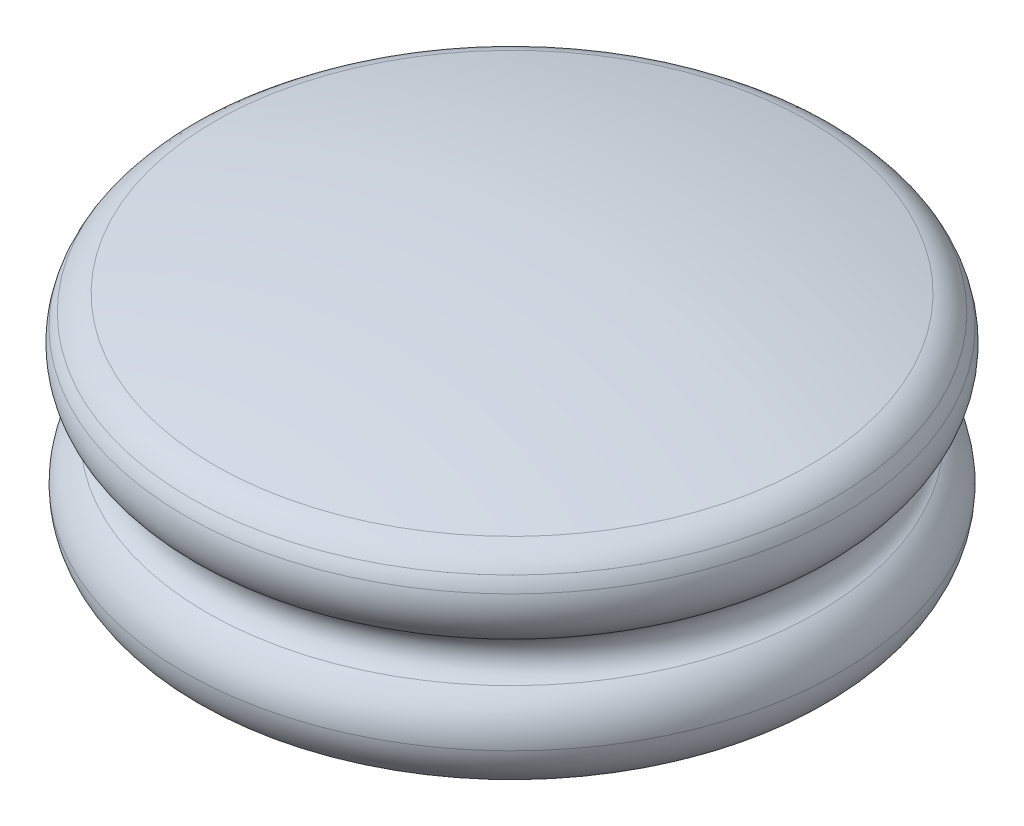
SolidWorks part; units mm, degrees
ref_plane "Alzado" through (0, 0, 0) normal (0, 0, 1) x (1, 0, 0)
ref_plane "Planta" through (0, 0, 0) normal (0, 1, 0) x (1, 0, 0)
ref_plane "Vista lateral" through (0, 0, 0) normal (1, 0, 0) x (0, 0, -1)
sketch "Croquis1" plane through (0, 0, 0) normal (0, 1, 0) x (1, 0, 0)
  circle A0 centre (0, 0) radius 30
extrude "Saliente-Extruir1" add sketch "Croquis1" along normal blind 90
sketch "Croquis2" plane through (0, 90, 0) normal (0, 1, 0) x (1, 0, 0)
  circle A0 centre (0, 0) radius 28
sketch "Croquis3" plane through (0, 90, 0) normal (0, 1, 0) x (1, 0, 0)
  line L0 (0, 0) -> (-30, 0) construction
  line L2 (-31, -1.5) -> (-29, -1.5)
  line L3 (-31, -1.5) -> (-31, 1.5)
  line L4 (-31, 1.5) -> (-29, 1.5)
  line L5 (-29, -1.5) -> (-29, 1.5)
  line L6 (-31, -1.5) -> (-29, 1.5) construction
  line L7 (-31, 1.5) -> (-29, -1.5) construction
  circle A0 centre (0, 0) radius 30 construction
  dimension "D1" = 3
  dimension "D2" = 2
extrude "Saliente-Extruir2" add sketch "Croquis3" against normal blind 3 separate body
ref_plane "Plano1" through (0, 85, 0) normal (0, 1, 0) x (1, 0, 0)
sketch "Croquis5" plane through (0, 85, 0) normal (0, 1, 0) x (1, 0, 0)
  line L0 (0, 0) -> (-29.2874, -6.5) construction
  line L5 (-31, -1.5) -> (-29, -1.5) construction
  line L6 (-30.1011, -7.4489) -> (-28.1486, -7.0155)
  line L7 (-28.1486, -7.0155) -> (-28.4736, -5.5511)
  line L8 (-28.4736, -5.5511) -> (-30.4261, -5.9845)
  line L9 (-30.4261, -5.9845) -> (-30.1011, -7.4489)
  circle A0 centre (0, 0) radius 30 construction
  dimension "D1" = 5
  dimension "D2" = 2
  dimension "D3" = 1
  dimension "D4" = 1.5
  dimension "D5" = 0.75
sketch "Croquis10" plane through (0, 0, 0) normal (1, 0, 0) x (0, 0, -1)
  line L0 (37.5, 90) -> (37.5, 100) construction
  line L1 (37.5, 100) -> (37.5, 105) construction
  line L2 (37.5, 105) -> (37.5, 115) construction
  line L3 (37.5, 115) -> (0, 115) construction
  line L4 (0, 115) -> (0, 90) construction
  line L5 (1.5, 90) -> (-1.5, 90) construction
  line L6 (0, 90) -> (37.5, 90) construction
  line L7 (37.5, 90) -> (40.2386, 90) construction
  line L8 (40.2386, 90) -> (40.2386, 115) construction
  line L9 (40.2386, 115) -> (37.5, 115) construction
  line L10 (0, 115) -> (0, 119.6645) construction
  line L11 (0, 119.6645) -> (0, 90)
  line L12 (0, 90) -> (37.5, 90)
  arc A3 (0, 119.6645) -> (36.5766, 115.2303) centre (0, -33.4063) cw
  arc A4 (39.5128, 113.1921) -> (40.2386, 111.6954) centre (34.8202, 109.9921) cw
  arc A5 (40.2386, 111.6954) -> (37.5, 105) centre (34.8365, 109.9972) cw
  arc A6 (37.5, 90) -> (40.2386, 95) centre (34.0561, 95.1363) ccw
  arc A7 (40.2386, 95) -> (37.5, 100) centre (34.0869, 94.8806) ccw
  arc A8 (37.5, 105) -> (37.5, 100) centre (38.8325, 102.5) ccw
  arc A9 (39.5128, 113.1921) -> (36.5766, 115.2303) centre (35.3818, 110.3751) ccw
  dimension "D1" = 5
revolve "Revolución4" add sketch "Croquis10" angle 360 about L11
sketch "Croquis13" plane through (0, 0, 0) normal (0, -1, 0) x (1, 0, 0)
  circle A0 centre (0, 0) radius 35.7488
extrude "Cortar-Extruir2" cut sketch "Croquis13" against normal blind 90
